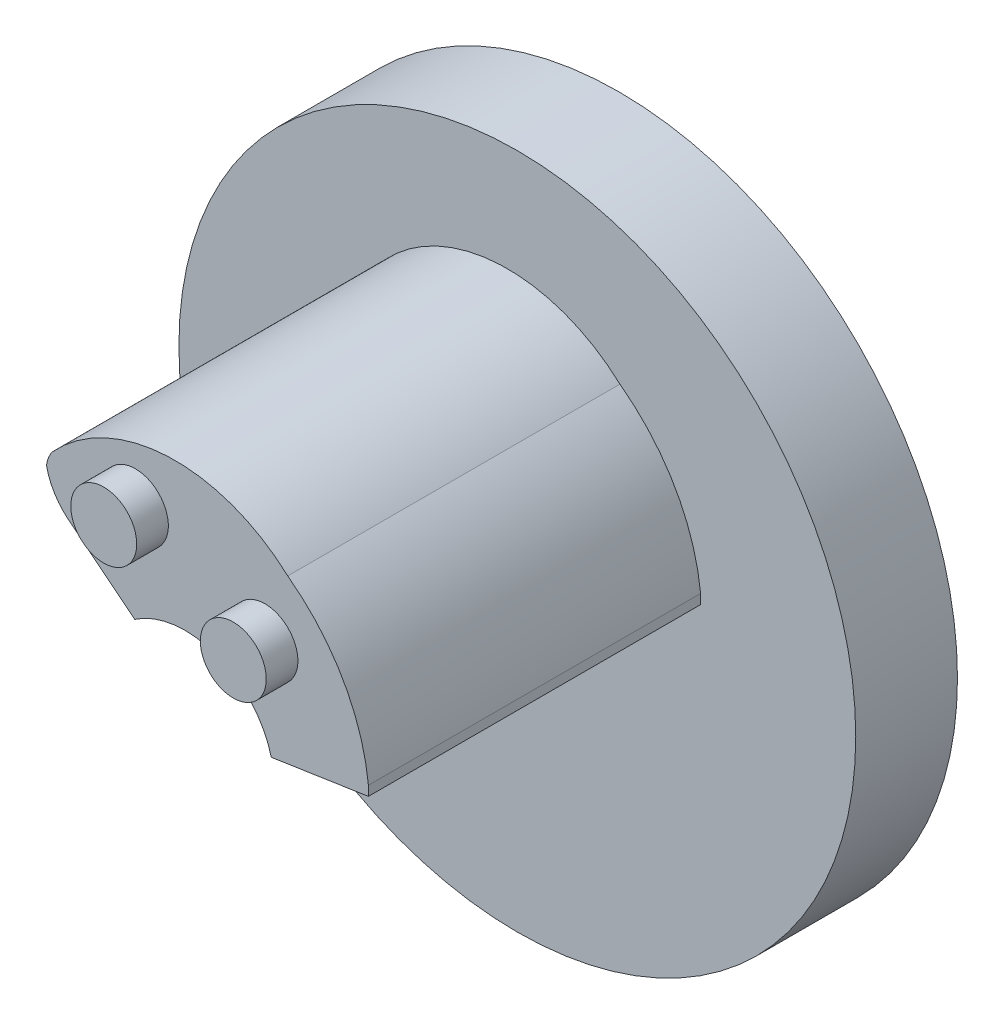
SolidWorks part; units mm, degrees
ref_plane "Front Plane" through (0, 0, 0) normal (0, 0, 1) x (1, 0, 0)
ref_plane "Top Plane" through (0, 0, 0) normal (0, 1, 0) x (1, 0, 0)
ref_plane "Right Plane" through (0, 0, 0) normal (1, 0, 0) x (0, 0, -1)
sketch "Sketch2" plane through (0, 0, 0) normal (0, 0, 1) x (1, 0, 0)
  line L0 (-12.1706, 0.0214) -> (13.2294, 0) construction
  line L2 (-4.9959, 2.1671) -> (-11.9439, 7.7293)
  line L3 (-2.1094, 5.5474) -> (-8.4511, 10.6242)
  line L4 (-22.4842, 39.5282) -> (-75.0057, 6.9478) construction
  arc A0 (-11.9439, 7.7293) -> (-15.4266, 6.9392) centre (-13.3706, 5.9471) ccw
  arc A1 (-15.4266, 6.9392) -> (-11.4141, -15.392) centre (-1.3118, -2.0507) ccw
  arc A2 (-11.4141, -15.392) -> (14.2893, -13.8698) centre (0.5472, 0.4042) ccw
  arc A3 (14.2893, -13.8698) -> (19.3612, 8.2079) centre (-1.1583, 1.3004) ccw
  arc A4 (19.3612, 8.2079) -> (6.4221, 20.9123) centre (-1.6042, -0.2035) ccw
  arc A5 (6.4221, 20.9123) -> (-7.7875, 20.6286) centre (-0.2381, -1.4991) ccw
  arc A6 (-7.7875, 20.6286) -> (-8.4511, 10.6242) centre (-4.6318, 15.3951) ccw
  arc A7 (-4.9959, 2.1671) -> (-2.1094, 5.5474) centre (2.7436, -1.5192) ccw
  dimension "D3" = 17.145
  dimension "D4" = 8.5725
  dimension "D1" = 25.4
  dimension "D2" = 4.445
extrude "Boss-Extrude1" add sketch "Sketch2" along normal blind 32.004 contours A5 A6 L3 A7 L2 A0 A1 A2 A3 A4
sketch "Sketch5" plane through (0, 0, 32.004) normal (0, 0, 1) x (1, 0, 0)
  circle A0 centre (-2.051, 14.969) radius 3.175
  circle A1 centre (10.4303, 9.947) radius 3.175
  circle A2 centre (-4.2666, -12.7262) radius 3.1817
  circle A3 centre (-12.0213, 0) radius 3.1817
  dimension "D1" = 6.35
extrude "Boss-Extrude2" add sketch "Sketch5" along normal blind 3.048 contours A0 | A1
ref_plane "Plane1" through (0, 0, 16.002) normal (0, 0, -1) x (-1, 0, 0)
sketch "Sketch6" plane through (0, 0, 35.052) normal (0, 0, 1) x (1, 0, 0)
  line L0 (-17.7363, 14.9853) -> (34.5576, -32.3662)
  line L1 (-17.7363, 14.9853) -> (-57.5654, -29.0011)
  line L2 (34.5576, -32.3662) -> (-5.2715, -76.3526)
  line L3 (-57.5654, -29.0011) -> (-5.2715, -76.3526)
extrude "Cut-Extrude1" [suppressed] cut sketch "Sketch6" against normal through all
sketch "Sketch7" plane through (0, 0, 0) normal (0, 0, -1) x (-1, 0, 0)
  line L2 (11.9439, 7.7293) -> (4.9959, 2.1671)
  line L3 (2.1094, 5.5474) -> (8.4511, 10.6242)
  line L6 (2.1094, 5.5474) -> (8.4511, 10.6242) construction
  circle A0 centre (-2.7436, -1.5192) radius 32.6053
  circle A1 centre (-2.7436, -1.5192) radius 8.5725 construction
  arc A4 (2.1094, 5.5474) -> (4.9959, 2.1671) centre (-2.7436, -1.5192) ccw
  arc A5 (-14.2893, -13.8698) -> (11.4141, -15.392) centre (-0.5472, 0.4042) ccw
  arc A6 (8.4511, 10.6242) -> (7.7875, 20.6286) centre (4.6318, 15.3951) ccw
  arc A7 (8.4511, 10.6242) -> (7.7875, 20.6286) centre (4.6318, 15.3951) ccw construction
  arc A8 (2.1094, 5.5474) -> (4.9959, 2.1671) centre (-2.7436, -1.5192) ccw construction
  arc A16 (7.7875, 20.6286) -> (-6.4221, 20.9123) centre (0.2381, -1.4991) ccw
  arc A17 (7.7875, 20.6286) -> (-6.4221, 20.9123) centre (0.2381, -1.4991) ccw construction
  arc A18 (-6.4221, 20.9123) -> (-19.3612, 8.2079) centre (1.6042, -0.2035) ccw
  arc A19 (-6.4221, 20.9123) -> (-19.3612, 8.2079) centre (1.6042, -0.2035) ccw construction
  arc A20 (-19.3612, 8.2079) -> (-14.2893, -13.8698) centre (1.1583, 1.3004) ccw
  arc A21 (-19.3612, 8.2079) -> (-14.2893, -13.8698) centre (1.1583, 1.3004) ccw construction
  arc A24 (11.4141, -15.392) -> (15.4266, 6.9392) centre (1.3118, -2.0507) ccw
  arc A25 (15.4266, 6.9392) -> (11.9439, 7.7293) centre (13.3706, 5.9471) ccw
  dimension "D1" = 0
extrude "Boss-Extrude3" add sketch "Sketch7" along normal blind 9.8
sketch "Sketch9" plane through (0, 0, 35.052) normal (0, 0, 1) x (1, 0, 0)
  line L0 (-2.2194, 5.6355) -> (-9.1674, 11.1976) construction
  line L1 (-4.9959, 2.1671) -> (-11.9439, 7.7293) construction
  line L2 (-9.0747, 11.1234) -> (-9.9555, 11.9228)
  line L3 (-2.1094, 5.5474) -> (-8.4511, 10.6242) construction
  line L4 (-25.9442, 21.7825) -> (5.4969, -3.3872) construction
  line L5 (-6.5298, 9.0861) -> (-9.3063, 5.6178) construction
  line L6 (-2.2194, 5.6355) -> (-9.0747, 11.1234) construction
  line L7 (-2.1094, 5.5474) -> (-9.0747, 11.1234)
  line L8 (11.0457, 0.6169) -> (20.4006, 2.0337)
  line L9 (20.4006, 2.9665) -> (20.4006, 2.0337)
  line L10 (-61.0564, -53.2563) -> (61.0564, -53.2563)
  line L11 (-61.0564, -53.2563) -> (-61.0564, 53.2563)
  line L12 (-61.0564, 53.2563) -> (61.0564, 53.2563)
  line L13 (61.0564, -53.2563) -> (61.0564, 53.2563)
  line L14 (-61.0564, -53.2563) -> (61.0564, 53.2563) construction
  line L15 (-61.0564, 53.2563) -> (61.0564, -53.2563) construction
  arc A0 (-9.1588, 14.7687) -> (13.5092, 15.7414) centre (2.7026, 2.9639) cw construction
  arc A1 (-9.1674, 11.1976) -> (-9.1588, 14.7687) centre (-7.7407, 12.9797) cw construction
  arc A3 (-15.4266, 6.9392) -> (-11.4141, -15.392) centre (-1.3118, -2.0507) ccw construction
  arc A4 (-11.9439, 7.7293) -> (-15.4266, 6.9392) centre (-13.3706, 5.9471) ccw construction
  arc A8 (-9.0747, 11.1234) -> (-9.1588, 14.7687) centre (-6.8106, 12.9993) cw construction
  arc A9 (-9.1588, 14.7687) -> (13.5092, 15.7414) centre (2.7026, 2.9639) cw construction
  arc A10 (13.5092, 15.7414) -> (15.7694, 13.7549) centre (1.5966, -0.0916) cw construction
  arc A11 (-2.1094, 5.5474) -> (11.0457, 0.6169) centre (2.7436, -1.5192) cw
  arc A12 (-9.9555, 11.9228) -> (-10.0396, 15.5681) centre (-7.6914, 13.7986) cw
  arc A13 (-10.0396, 15.5681) -> (12.6284, 16.5407) centre (1.7823, 4.6827) cw
  arc A14 (12.6284, 16.5407) -> (20.4006, 2.9665) centre (1.1245, 0.9417) cw
  arc A15 (11.0457, 0.6169) -> (-2.1094, 5.5474) centre (2.7436, -1.5192) ccw construction
  point P25 (0, 0)
extrude "Cut-Extrude5" cut sketch "Sketch9" against normal up to surface (35.052 mm away)
sketch "Sketch10" plane through (0, 0, 0) normal (0, 0, 1) x (1, 0, 0)
  arc A0 (11.0457, 0.6169) -> (-2.1094, 5.5474) centre (2.7436, -1.5192) ccw construction
  arc A1 (11.0457, 0.6169) -> (-2.1094, 5.5474) centre (2.7436, -1.5192) ccw construction
  circle A2 centre (2.7436, -1.5192) radius 8.5725
extrude "Cut-Extrude6" cut sketch "Sketch10" against normal through all
ref_plane "Plane2" through (0, 0, 11.102) normal (0, 0, 1) x (1, 0, 0)
mirror "Mirror1" about plane through (0, 0, 11.102) normal (0, 0, 1) of "Boss-Extrude2"
ref_plane "Plane3" through (0, 0, -27.58) normal (0, 0, -1) x (-1, 0, 0)
